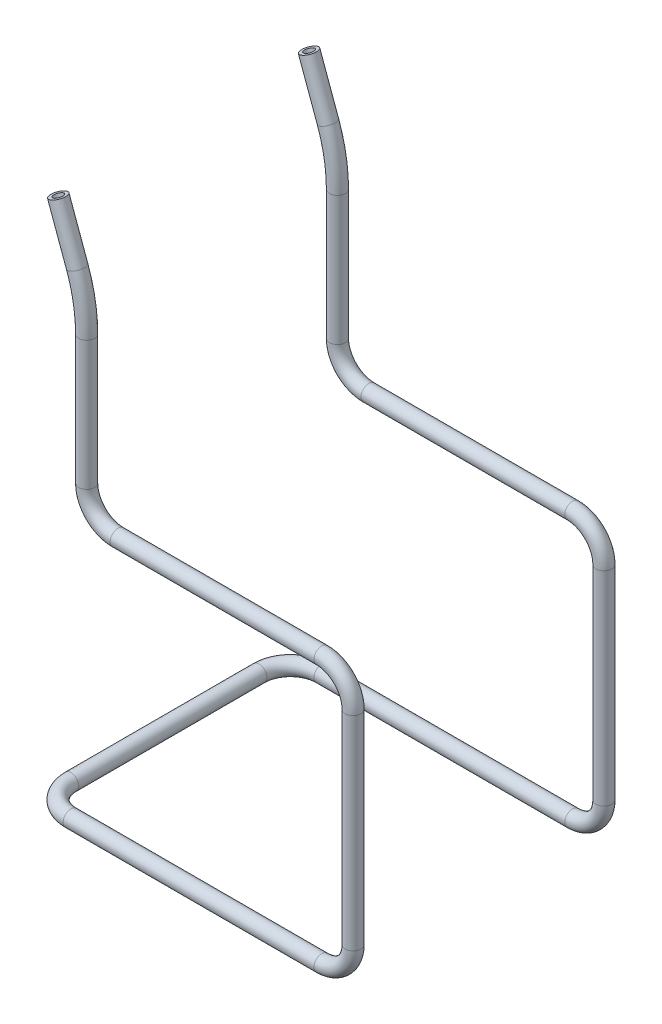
SolidWorks part; units mm, degrees
ref_plane "Front Plane" through (0, 0, 0) normal (0, 0, 1) x (1, 0, 0)
ref_plane "Top Plane" through (0, 0, 0) normal (0, 1, 0) x (1, 0, 0)
ref_plane "Right Plane" through (0, 0, 0) normal (1, 0, 0) x (0, 0, -1)
ref_plane "Plane1" through (0, 0, 40) normal (0, 0, 1) x (1, 0, 0)
sketch3d "3DSketch1"
  line L0 (0, 0, 0) -> (0, 0, 30)
  line L1 (10, 0, 40) -> (90, 0, 40)
  line L2 (100, 10, 40) -> (100, 75, 40)
  line L3 (90, 85, 40) -> (25, 85, 40)
  line L4 (15, 95, 40) -> (15, 136.1837, 40)
  line L5 (11.9846, 153.2847, 40) -> (5.9385, 169.8962, 40)
  arc A0 (25, 85, 40) -> (15, 95, 40) centre (25, 95, 40) ccw
  arc A1 (100, 75, 40) -> (90, 85, 40) centre (90, 75, 40) ccw
  arc A2 (90, 0, 40) -> (100, 10, 40) centre (90, 10, 40) ccw
  arc A3 (0, 0, 30) -> (10, 0, 40) centre (10, 0, 30) ccw
  arc A4 (15, 136.1837, 40) -> (11.9846, 153.2847, 40) centre (-35, 136.1837, 40) ccw
  point P10 (15, 85, 40)
  point P11 (25, 95, 30)
  point P14 (100, 85, 40)
  point P15 (90, 75, 50)
  point P18 (100, 0, 40)
  point P19 (90, 10, 50)
  point P22 (0, 0, 40)
  point P23 (10, 10, 30)
  point P26 (15, 145, 40)
  point P27 (-35, 136.1837, 90)
  dimension "D1" = 10
  dimension "D8" = 50
  dimension "D2" = 40
  dimension "D3" = 100
  dimension "D4" = 85
  dimension "D5" = 85
  dimension "D6" = 20
  dimension "D7" = 60
  dimension "D9" = 170
sketch "Sketch1" plane through (0, 0, 0) normal (0, 0, 1) x (1, 0, 0)
  circle A0 centre (0, 0) radius 2.5
  dimension "D1" = 5
sweep "Sweep-Thin1" add profiles "Sketch1" path "3DSketch1" parameters "D1"=1
mirror "Mirror1" about plane through (0, 0, 0) normal (0, 0, 1) of "Sweep-Thin1"
